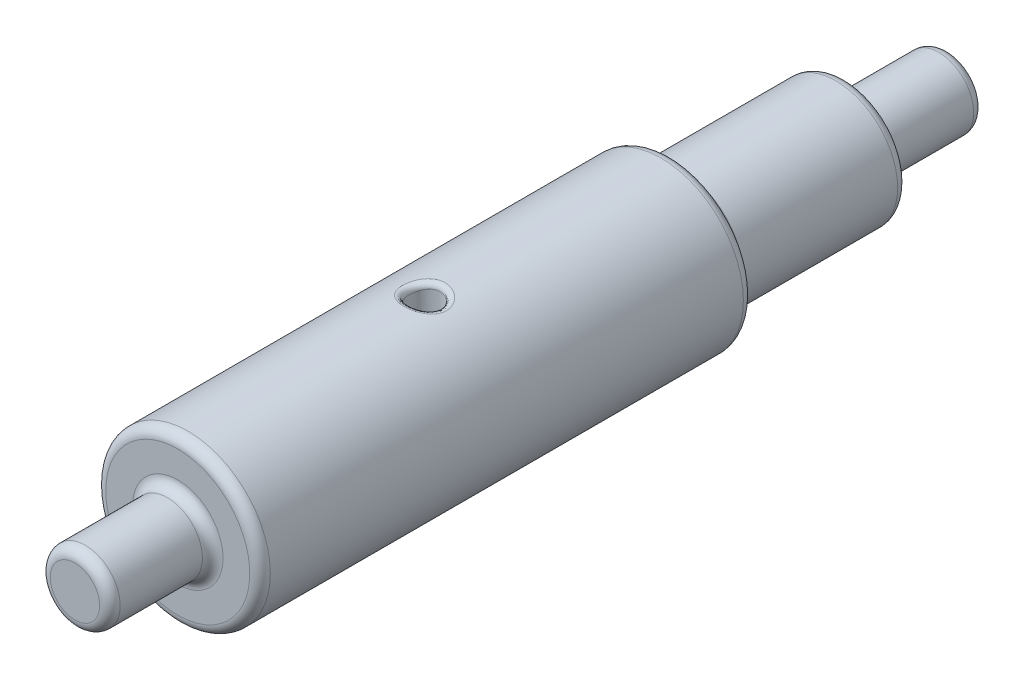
SolidWorks part; units mm, degrees
ref_plane "Спереди" through (0, 0, 0) normal (0, 0, 1) x (1, 0, 0)
ref_plane "Сверху" through (0, 0, 0) normal (0, 1, 0) x (1, 0, 0)
ref_plane "Справа" through (0, 0, 0) normal (1, 0, 0) x (0, 0, -1)
sketch "Эскиз1" plane through (0, 0, 0) normal (1, 0, 0) x (0, 0, -1)
  line L0 (-21.25, 0) -> (21.25, 0)
  line L1 (21.25, 0) -> (21.25, 1.7)
  line L2 (21.25, 1.7) -> (16.25, 1.7)
  line L3 (16.25, 1.7) -> (16.25, 3)
  line L4 (16.25, 3) -> (7.75, 3)
  line L5 (7.75, 3) -> (7.75, 4)
  line L6 (7.75, 4) -> (-16.25, 4)
  line L7 (-16.25, 4) -> (-16.25, 1.7)
  line L8 (-16.25, 1.7) -> (-21.25, 1.7)
  line L9 (-21.25, 1.7) -> (-21.25, 0)
  dimension "D1" = 1.7
  dimension "D2" = 5
  dimension "D3" = 3
  dimension "D4" = 4
  dimension "D5" = 24
  dimension "D6" = 8.5
revolve "Повернуть1" add sketch "Эскиз1" angle 360 about L0
sketch "Эскиз2" plane through (0, 0, 0) normal (0, 1, 0) x (1, 0, 0)
  line L0 (-4, -16.25) -> (4, -16.25) construction
  circle A0 centre (0, -4.25) radius 0.75
  dimension "D1" = 1.5
  dimension "D2" = 12
extrude "Вырез-Вытянуть1" cut sketch "Эскиз2" against normal mid plane 10
fillet "Скругление1" radius 0.5 8 edges at (1.7, 0, -21.25) (1.7, 0, -16.25) (3, 0, -16.25) (3, 0, -7.75) (1.7, 0, 16.25) (1.7, 0, 21.25) (4, 0, -7.75) (4, 0, 16.25)
fillet "Скругление2" radius 0.25 2 edges at (-0.1578, -3.9969, 3.5168) (0.1578, 3.9969, 3.5168)
